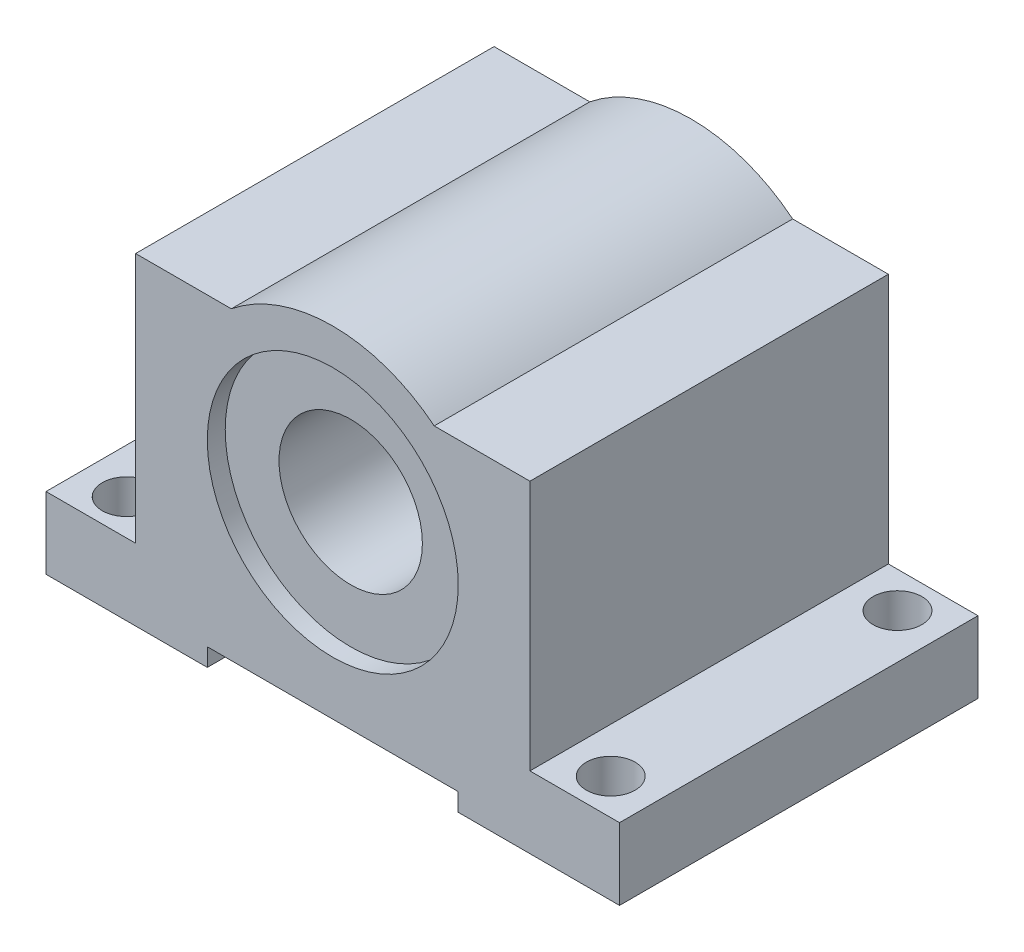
SolidWorks part; units mm, degrees
ref_plane "Front" through (0, 0, 0) normal (0, 0, 1) x (1, 0, 0)
ref_plane "Top" through (0, 0, 0) normal (0, 1, 0) x (1, 0, 0)
ref_plane "Right" through (0, 0, 0) normal (1, 0, 0) x (0, 0, -1)
sketch "Sketch1"
  dimension "A" = 17.4498
  dimension "B" = 50.8
  dimension "J" = 6.35
  dimension "K" = 28.575
  dimension "G" = 34.925
extrude "Base" add sketch "Sketch1" along normal mid plane 31.75
sketch "Sketch2"
  dimension "D1" = 31.75
extrude "Top Housing" add sketch "Sketch2" along normal up to surface and the other way up to surface
sketch "Sketch3"
  dimension "D1" = 12.7
extrude "Bearing Center" cut sketch "Sketch3" against normal through all and the other way through all
sketch "Sketch5"
  dimension "D1" = 30
  dimension "D3" = 7.9375
extrude "Open Cut" [suppressed] cut sketch "Sketch5" against normal through all flip side to cut
sketch "Sketch4"
  dimension "D1" = 22.225
extrude "Retention Ring" cut sketch "Sketch4" against normal blind 1.5875
mirror "Mirror1" of "Retention Ring"
sketch "Sketch6"
  dimension "H" = 4.318
  dimension "E" = 42.8752
  dimension "F" = 25.4
extrude "Mounting Holes" cut sketch "Sketch6" against normal through all
sketch "Sketch7"
  dimension "D1" = 1.5875
extrude "Base Notch" cut sketch "Sketch7" against normal through all
sketch "Sketch8" [suppressed]
sketch "Sketch9" [suppressed]
